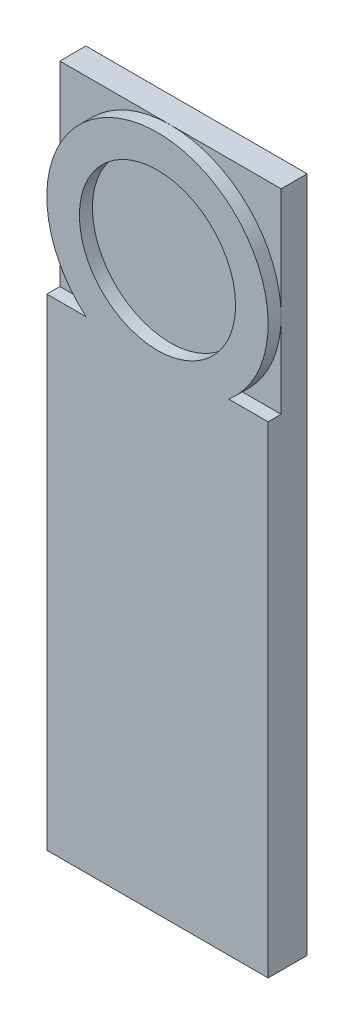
SolidWorks part; units mm, degrees
ref_plane "Front Plane" through (0, 0, 0) normal (0, 0, 1) x (1, 0, 0)
ref_plane "Top Plane" through (0, 0, 0) normal (0, 1, 0) x (1, 0, 0)
ref_plane "Right Plane" through (0, 0, 0) normal (1, 0, 0) x (0, 0, -1)
sketch "Sketch1" plane through (0, 0, 0) normal (0, 0, 1) x (1, 0, 0)
  circle A0 centre (0, 0) radius 12
  circle A1 centre (0, 0) radius 17
  dimension "D1" = 24
  dimension "D2" = 5
extrude "Boss-Extrude1" add sketch "Sketch1" along normal blind 4
sketch "Sketch2" plane through (0, 0, 0) normal (0, 0, -1) x (-1, 0, 0)
  line L1 (-17, 17) -> (17, 17)
  line L2 (-17, 17) -> (-17, -17)
  line L3 (-17, -17) -> (17, -17)
  line L4 (17, 17) -> (17, -17)
  line L5 (-17, 17) -> (17, -17) construction
  line L6 (-17, -17) -> (17, 17) construction
  circle A0 centre (0, 0) radius 17 construction
  circle A1 centre (0, 0) radius 17
extrude "Boss-Extrude3" add sketch "Sketch2" along normal blind 4 contours L1 L2 M1 | L2 L3 M1 | L4 L3 M1 | L4 L1 M1 | M1 M2 | M2
sketch "Sketch4" plane through (0, -17, 0) normal (0, -1, 0) x (1, 0, 0)
  line L0 (17, 4) -> (-17, 4) construction
  line L1 (-17, -4) -> (17, -4)
  line L2 (-17, -4) -> (-17, 4)
  line L3 (-17, 4) -> (17, 4)
  line L4 (17, -4) -> (17, 4)
  line L5 (17, 4) -> (-17, 4)
  point P7 (17, 4.4216)
extrude "Boss-Extrude6" add sketch "Sketch4" against normal blind 4 contours L4 L3 L2 M1 M2
sketch "Sketch5" plane through (0, -17, 0) normal (0, -1, 0) x (1, 0, 0)
  line L0 (17, -4) -> (17, 4) construction
  line L1 (17, -4) -> (-17, -4) construction
  line L2 (-17, 4) -> (17, 4) construction
  line L3 (-17, -4) -> (-17, 4) construction
  line L4 (17, -4) -> (17, 4)
  line L5 (17, -4) -> (-17, -4)
  line L6 (-17, 4) -> (17, 4)
  line L7 (-17, -4) -> (-17, 4)
extrude "Boss-Extrude7" add sketch "Sketch5" along normal blind 70
sketch "Sketch6" plane through (0, 0, 4) normal (0, 0, 1) x (1, 0, 0)
  line L0 (-10.9545, -13) -> (-17, -13) construction
  line L1 (-17, -13) -> (-17, -87) construction
  line L2 (17, -87) -> (-17, -87) construction
  line L3 (17, -13) -> (17, -87) construction
  line L4 (10.9545, -13) -> (17, -13) construction
  line L5 (-10.9545, -13) -> (-17, -13)
  line L6 (-17, -13) -> (-17, -87)
  line L7 (17, -87) -> (-17, -87)
  line L8 (17, -13) -> (17, -87)
  line L9 (10.9545, -13) -> (17, -13)
  circle A0 centre (0, 0) radius 12 construction
  arc A1 (10.9545, -13) -> (-10.9545, -13) centre (0, 0) ccw construction
  circle A2 centre (0, 0) radius 12
  arc A3 (10.9545, -13) -> (-10.9545, -13) centre (0, 0) ccw
extrude "Cut-Extrude1" cut sketch "Sketch6" against normal blind 2
